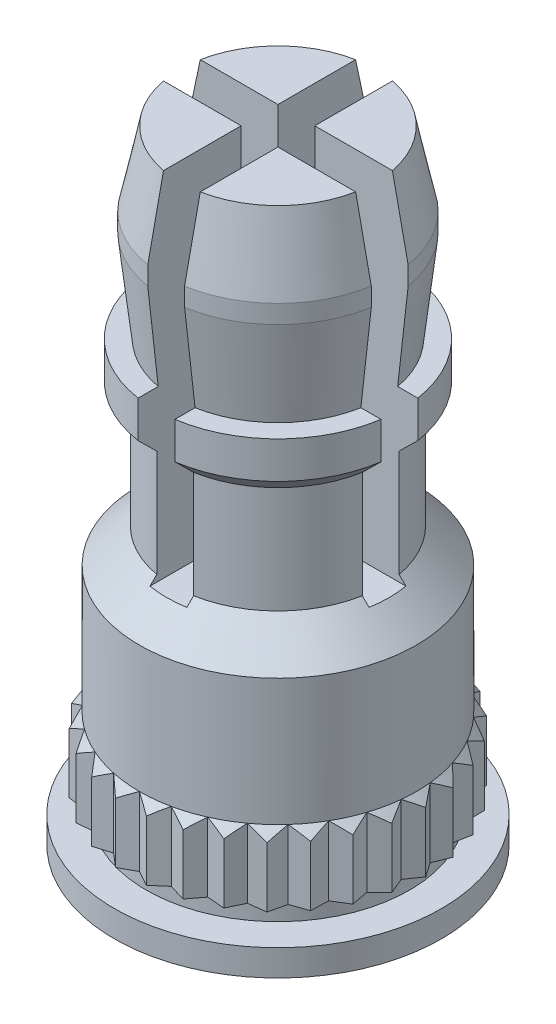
SolidWorks part; units mm, degrees
ref_plane "Plane1" through (0, 0, 0) normal (0, 0, 1) x (1, 0, 0)
ref_plane "Plane2" through (0, 0, 0) normal (0, 1, 0) x (1, 0, 0)
ref_plane "Plane3" through (0, 0, 0) normal (1, 0, 0) x (0, 0, -1)
sketch "BodySke" plane through (0, 0, 0) normal (0, 0, 1) x (1, 0, 0)
  line L0 (2.5555, 0) -> (2.5555, 0.3825)
  line L1 (2.69, 4.1891) -> (2.0272, 4.8518)
  line L2 (2.87, 1.5475) -> (2.69, 1.7275)
  line L3 (2.0272, 4.8518) -> (2.0272, 6.9267)
  line L4 (0, -0.51) -> (3.175, -0.51)
  line L5 (3.175, -0.51) -> (3.175, 0)
  line L6 (3.175, 0) -> (2.5555, 0)
  line L7 (2.385, 7.2845) -> (2.385, 8)
  line L8 (2.69, 1.7275) -> (2.69, 4.1891)
  line L9 (0, -0.51) -> (0, 17.145) construction
  line L10 (2.385, 8) -> (2, 8)
  line L11 (2, 8) -> (2.2, 9.79)
  line L12 (2.2, 9.79) -> (2.2, 10.148)
  line L13 (2.2, 10.148) -> (1.9, 11.58)
  line L14 (1.9, 11.58) -> (0, 11.58)
  line L15 (2.5555, 0.3825) -> (2.87, 0.3825)
  line L16 (2.87, 0.3825) -> (2.87, 1.5475)
  line L17 (0, 11.58) -> (0, -0.51)
  line L19 (2.385, 7.2845) -> (2.0272, 6.9267)
  dimension "H_dia" = 6.35
  dimension "D4" = 45
  dimension "T_ht" = 0.51
  dimension "Clinch_dia" = 5.74
  dimension "C_dia" = 5.38
  dimension "Groove_dia" = 5.111
  dimension "Groove_wid" = 0.3825
  dimension "Clinch_lim" = 1.345
  dimension "Length" = 8
  dimension "D_ht" = 3.58
  dimension "Neck_dia" = 4.0545
  dimension "B_dia" = 4.77
  dimension "B_ht" = 0.7155
  dimension "Panel_dia" = 4
  dimension "Slip_dia" = 4.4
  dimension "Tip_dia" = 3.8
  dimension "Grip_ht" = 1.79
  dimension "Slip_ht" = 0.358
  dimension "Neck_len" = 3.1482
revolve "Body" add sketch "BodySke" angle 360 about L9
sketch "SlitCutSke" plane through (0, 11.58, 0) normal (0, 1, 0) x (-1, 0, 0)
  line L0 (-2.6661, 0.3578) -> (2.6661, 0.3578)
  line L1 (2.6661, -0.3578) -> (-2.6661, -0.3578)
  line L2 (-2.6661, 0.3578) -> (-2.6661, -0.3578)
  line L3 (2.6661, 0.3578) -> (2.6661, -0.3578)
  line L4 (-4.064, 0) -> (4.064, 0) construction
  circle A1 centre (0, 0) radius 2.69 construction
  dimension "Width" = 0.7155
extrude "SlitCut" cut sketch "SlitCutSke" against normal blind 6.8582
pattern_circular "SlitCutPat" count 2 every 90 about axis through (0, -0.51, 0) along (0, 1, 0) of "SlitCut"
ref_plane "Plane4" through (0, -0.5486, 0) normal (0, 1, 0) x (-1, 0, 0)
sketch "CliRinCutSke" plane through (0, 0.3825, 0) normal (0, -1, 0) x (1, 0, 0)
  line L0 (0.3, 2.8543) -> (0, 2.69)
  line L1 (0, 2.69) -> (-0.3, 2.8543)
  line L2 (0, 0) -> (0, 5.842) construction
  arc A1 (0.3, 2.8543) -> (-0.3, 2.8543) centre (0, 0) ccw
  circle A2 centre (0, 0) radius 2.69 construction
  dimension "Clinch_dia" = 5.74
  dimension "Clinch_minor" = 5.38
  dimension "Angle" = 12
extrude "ClinchCut" cut sketch "CliRinCutSke" against normal blind 1.345
pattern_circular "ClinchCutPat" count 30 every 12 about axis through (0, -0.51, 0) along (0, 1, 0) of "ClinchCut"
equation "' \"Panel_dia@BodySke\" = 4"
equation "' \"Length@BodySke\" = 8"
equation "' \"B_dia@BodySke\" = 4.77"
equation "' \"C_dia@BodySke\" = 5.38"
equation "' \"D_ht@BodySke\" = 3.58"
equation "' \"H_dia@BodySke\" = 6.35"
equation "' \"T_ht@BodySke\" = 0.51"
equation "' \"Clinch_dia@BodySke\" = 5.74"
equation "\"Tip_dia@BodySke\" = \"Panel_dia@BodySke\" * 0.95"
equation "\"Slip_dia@BodySke\" = \"Panel_dia@BodySke\" * 1.1"
equation "\"Slip_ht@BodySke\" = \"D_ht@BodySke\" * 0.1"
equation "\"Grip_ht@BodySke\" = \"D_ht@BodySke\" * 0.5"
equation "\"B_ht@BodySke\" = \"B_dia@BodySke\" * 0.15"
equation "\"Neck_dia@BodySke\" = \"B_dia@BodySke\" * 0.85"
equation "\"Neck_len@BodySke\" = \"B_dia@BodySke\" * 0.66"
equation "\"Groove_dia@BodySke\" = \"C_dia@BodySke\" * 0.95"
equation "\"Groove_wid@BodySke\" = \"T_ht@BodySke\" * 0.75"
equation "\"Width@SlitCutSke\" = \"B_ht@BodySke\""
equation "\"Depth@SlitCut\" = \"D_ht@BodySke\" + \"Neck_len@BodySke\" + 0.13"
equation "\"Clinch_lim@BodySke\" = \"C_dia@BodySke\" * 0.25"
equation "\"Count@ClinchCutPat\" = 30"
equation "\"Angle@ClinchCutPat\" = 360 / \"Count@ClinchCutPat\""
equation "\"Angle@CliRinCutSke\" = 360 / \"Count@ClinchCutPat\""
equation "\"Clinch_dia@CliRinCutSke\" = \"Clinch_dia@BodySke\""
equation "\"Clinch_minor@CliRinCutSke\" = \"C_dia@BodySke\""
equation "\"Depth@ClinchCut\" = \"Clinch_lim@BodySke\""
